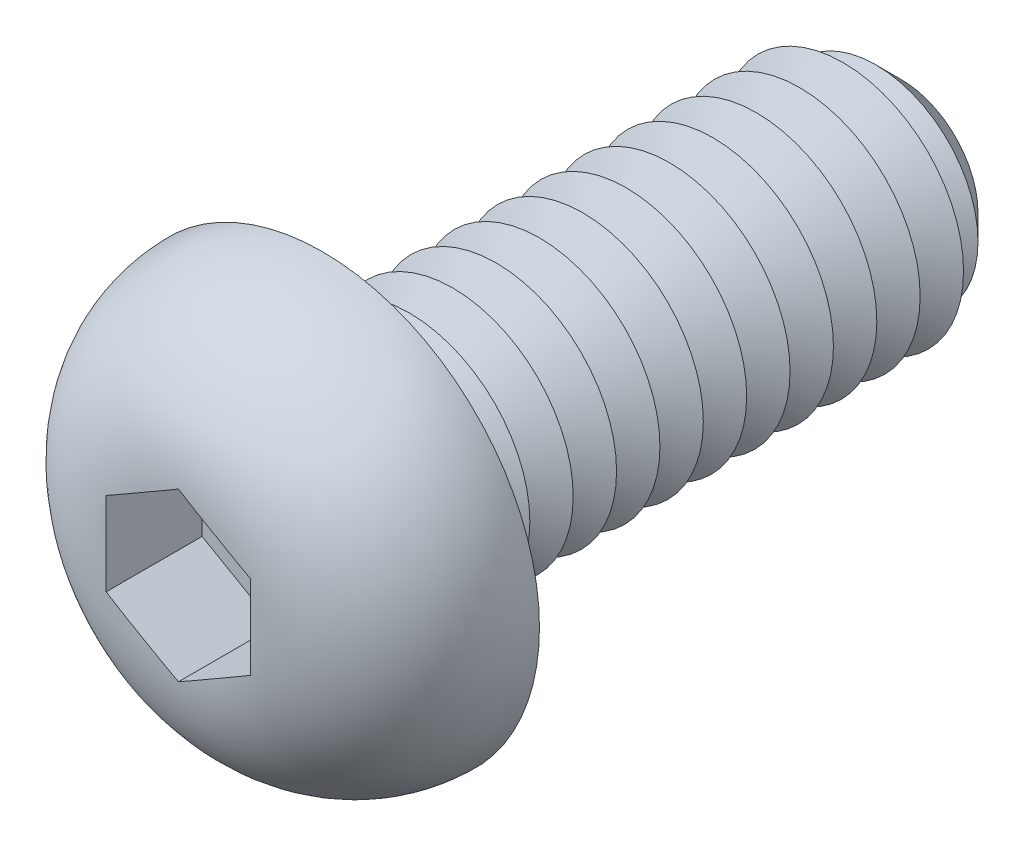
SolidWorks part; units mm, degrees
ref_plane "Front Plane" through (0, 0, 0) normal (0, 0, 1) x (1, 0, 0)
ref_plane "Top Plane" through (0, 0, 0) normal (0, 1, 0) x (1, 0, 0)
ref_plane "Right Plane" through (0, 0, 0) normal (1, 0, 0) x (0, 0, -1)
sketch "Sketch1" plane through (0, 0, 0) normal (1, 0, 0) x (0, 0, -1)
  line L0 (-47.9342, 0) -> (60.3146, 0) construction
sketch "Sketch2" plane through (0, 0, 0) normal (1, 0, 0) x (0, 0, -1)
  line L0 (0, 0) -> (-1.5, 0)
  line L1 (-47.9342, 0) -> (60.3146, 0) construction
  line L2 (-1.5, 0) -> (-1.5, 0.75)
  line L3 (0, 2.25) -> (0, 0)
  arc A0 (-1.5, 0.75) -> (0, 2.25) centre (0, 0.75) cw
  dimension "D1" = 1.5
  dimension "D2" = 1.5
  dimension "D3" = 2.25
revolve "Revolve1" add sketch "Sketch2" angle 360 about L0
sketch "Sketch3" plane through (0, 0, 1.5) normal (0, 0, 1) x (1, 0, 0)
  line L1 (0, 0.866) -> (-0.75, 0.433)
  line L2 (-0.75, 0.433) -> (-0.75, -0.433)
  line L3 (-0.75, -0.433) -> (0, -0.866)
  line L4 (0, -0.866) -> (0.75, -0.433)
  line L5 (0.75, -0.433) -> (0.75, 0.433)
  line L6 (0.75, 0.433) -> (0, 0.866)
  circle A0 centre (0, 0) radius 0.75 construction
  dimension "D1" = 1.5
extrude "Cut-Extrude1" cut sketch "Sketch3" against normal blind 1
sketch "Sketch4" plane through (0, 0, 0) normal (0, 0, -1) x (-1, 0, 0)
  circle A0 centre (0, 0) radius 1.25
  dimension "D1" = 2.5
extrude "Boss-Extrude1" add sketch "Sketch4" along normal blind 6
chamfer "Chamfer1" distance 0.45 angle 45 1 edges at (-1.25, 0, -6)
sketch "Sketch5" plane through (0, 0, 0) normal (1, 0, 0) x (0, 0, -1)
  line L0 (0.45, 1.25) -> (0.9, 1.25)
  line L1 (5.55, 1.25) -> (0, 1.25) construction
  line L2 (0.9, 1.25) -> (0.675, 0.8603)
  line L3 (0.675, 0.8603) -> (0.45, 1.25)
  line L4 (0, -2.25) -> (0, 2.25) construction
  line L5 (5.55, 1.25) -> (0, 1.25) construction
  dimension "D1" = 0.45
  dimension "D2" = 0.45
revolve "Cut-Revolve1" cut sketch "Sketch5" angle 360 about L0
pattern_linear "LPattern1" count 12 spacing 0.45 along (0, 0, -1) of "Cut-Revolve1"
fillet "Fillet2" radius 0.225 1 edges at (1.25, 0, 0)
sketch "Sketch6" plane through (0, 0, 0.5) normal (0, 0, 1) x (1, 0, 0)
  circle A0 centre (0, 0) radius 0.45
  dimension "D1" = 0.9
extrude "Cut-Extrude2" cut sketch "Sketch6" against normal up to surface (6.5 mm away)
